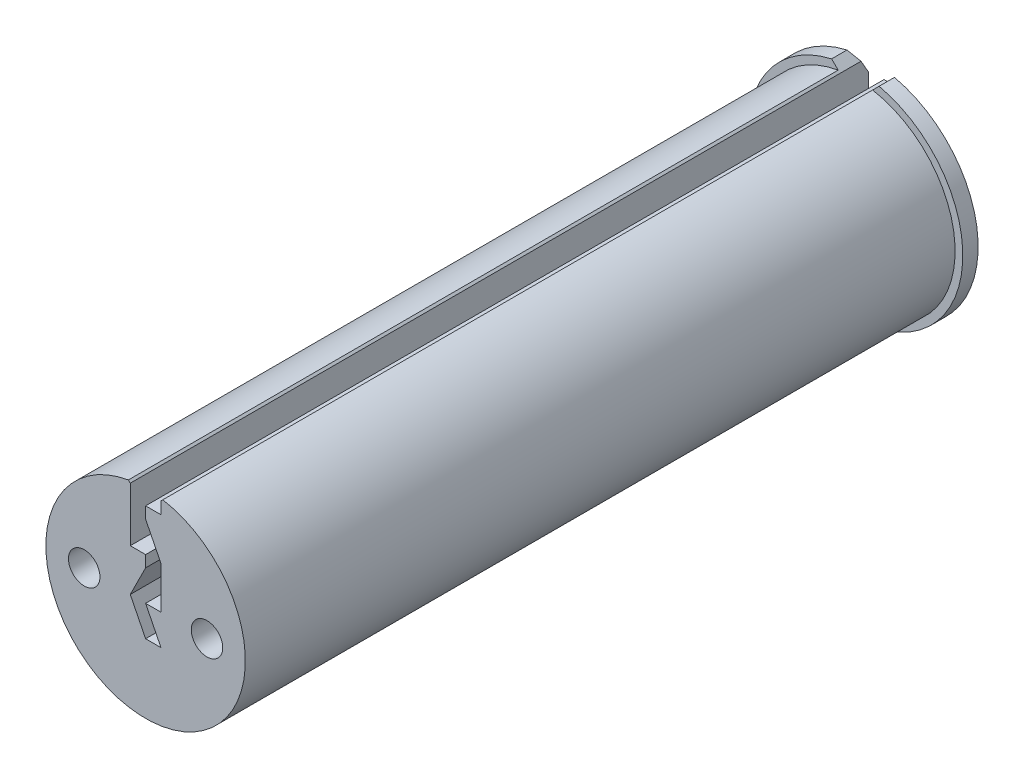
SolidWorks part; units mm, degrees
ref_plane "Plan de face" through (0, 0, 0) normal (0, 0, 1) x (1, 0, 0)
ref_plane "Plan de dessus" through (0, 0, 0) normal (0, 1, 0) x (1, 0, 0)
ref_plane "Plan de droite" through (0, 0, 0) normal (1, 0, 0) x (0, 0, -1)
sketch "Esquisse1" plane through (0, 0, 0) normal (1, 0, 0) x (0, 0, -1)
  line L0 (44, 6.5) -> (-2, 6.5) construction
  line L1 (44, 6.5) -> (-2, 6.5)
  line L2 (44, 6.5) -> (44, 7)
  line L3 (45, 7) -> (45.866, 5.5)
  line L4 (45.866, 5.5) -> (45.866, 0)
  line L5 (0, 0) -> (46.6909, 0) construction
  line L6 (-2, -6.5) -> (23, -6.5) construction
  line L7 (45, 7) -> (44, 7) construction
  line L8 (-2, 6.5) -> (-2, 0) construction
  line L9 (-2, 0) -> (45.866, 0)
  line L10 (44, 7) -> (45, 7)
  line L11 (-2.25, 0) -> (-2.25, 6.5)
  line L12 (-2.25, 6.5) -> (-2, 6.5)
  line L13 (-2.25, 0) -> (-2, 0)
  dimension "D1" = 120
  dimension "D2" = 1.5
  dimension "D3" = 0.25
revolve "Révolution1" add sketch "Esquisse1" angle 360 about L5
ref_plane "Plan1" through (0, -6.5, 0) normal (0, -1, 0) x (1, 0, 0)
sketch "Esquisse5" plane through (0, 0, -45.866) normal (0, 0, -1) x (-1, 0, 0)
  line L0 (0, 0) -> (0, 4) construction
  line L1 (-1, 6.9282) -> (-1, 5.5)
  line L2 (1, 6.9282) -> (1, 2.75)
  line L3 (0, 0) -> (-1, 0)
  line L4 (0, 0) -> (-1, -2)
  line L5 (-1, -2) -> (0, -2)
  line L6 (0, -2) -> (1, 0)
  line L7 (0, 2) -> (0, 2.75)
  line L8 (1, 0) -> (0, 0) construction
  line L9 (1, 0) -> (0, 2)
  line L10 (0, 2.75) -> (1, 2.75)
  line L11 (-1, 2.75) -> (0, 4.75)
  line L12 (0, 4.75) -> (0, 5.5)
  line L13 (0, 5.5) -> (-1, 5.5)
  line L14 (-1, 2.75) -> (-1, 0)
  line L15 (0, 0) -> (0, -7) construction
  circle A0 centre (0, 0) radius 7 construction
  arc A1 (1, 6.9282) -> (-1, 6.9282) centre (0, 0) ccw
  circle A3 centre (0, 0) radius 6.5 construction
  circle A4 centre (0, 0) radius 6.5 construction
  point P20 (0, 6.5)
  point P21 (0, -7)
  dimension "D2" = 2
  dimension "D1" = 2
  dimension "D3" = 2
  dimension "D4" = 0.75
  dimension "D5" = 1
extrude "Enlèv. mat.-Extru.2" cut sketch "Esquisse5" against normal through all
sketch "Esquisse2" plane through (0, -6.5, 0) normal (0, -1, 0) x (1, 0, 0)
  circle A0 centre (0, -24.5) radius 1.5 construction
  circle A1 centre (0, -28.5) radius 1.5 construction
  circle A2 centre (0, -32.5) radius 1.5 construction
  circle A3 centre (0, -36.5) radius 1.5 construction
  circle A4 centre (0, -40.5) radius 1.5 construction
  circle A5 centre (0, -24.5) radius 1.5
  circle A6 centre (0, -28.5) radius 1.5
  circle A7 centre (0, -32.5) radius 1.5
  circle A8 centre (0, -36.5) radius 1.5
  circle A9 centre (0, -40.5) radius 1.5
extrude "Enlèv. mat.-Extru.1" cut sketch "Esquisse2" against normal up to surface (6.5 mm away)
hole_wizard "Trou taraudé M2.5x0.451" positions "Esquisse4" profile "Esquisse3" tap size "M2.5x0.45" standard "Ansi Métrique"
sketch "Esquisse4" plane through (2.589, -3.7043, 2.25) normal (0, 0, 1) x (1, 0, 0)
  line L0 (-6.589, 3.7043) -> (1.411, 3.7043) construction
  point P0 (-6.589, 3.7043)
  point P10 (1.411, 3.7043)
  dimension "D1" = 8
sketch "Esquisse3" plane through (-4, 0, 2.25) normal (1, 0, 0) x (0, -1, 0)
  line L0 (0, 0) -> (0, 10.6159)
  line L1 (0, 10.6159) -> (1.025, 10)
  line L2 (1.025, 10) -> (1.025, 0)
  line L5 (1.025, 0) -> (0, 0)
  line L10 (0, 10.6159) -> (-1.025, 10) construction
  line L11 (0, -6.35) -> (0, 107.95) construction
  dimension "Diamètre du trou pour taraudage" = 2.05
  dimension "Profondeur du trou pour taraudage" = 10
  dimension "Angle de pointe" = 118
sketch "Esquisse6" plane through (0, 0, -45.866) normal (0, 0, -1) x (-1, 0, 0)
  line L0 (-0.7188, 6) -> (0.7188, 6)
  line L1 (0.7188, 6) -> (3.7188, 9)
  line L2 (3.7188, 9) -> (-3.7188, 9)
  line L3 (-3.7188, 9) -> (-0.7188, 6)
  line L4 (0, 0) -> (0, 6) construction
  line L5 (0, 5.5) -> (-1, 5.5) construction
  dimension "D1" = 3
  dimension "D2" = 0.5
  dimension "D3" = 45
  dimension "D4" = 0.1
  dimension "D5" = 45
extrude "Enlèv. mat.-Extru.3" cut sketch "Esquisse6" against normal through all
chamfer "Chanfrein1" distance 0.25 angle 45 5 edges at (0.3008, -6.493, -39.0305) (0.3008, -6.493, -35.0305) (0.3008, -6.493, -31.0305) (0.3008, -6.493, -27.0305) (0.3008, -6.493, -23.0305)
